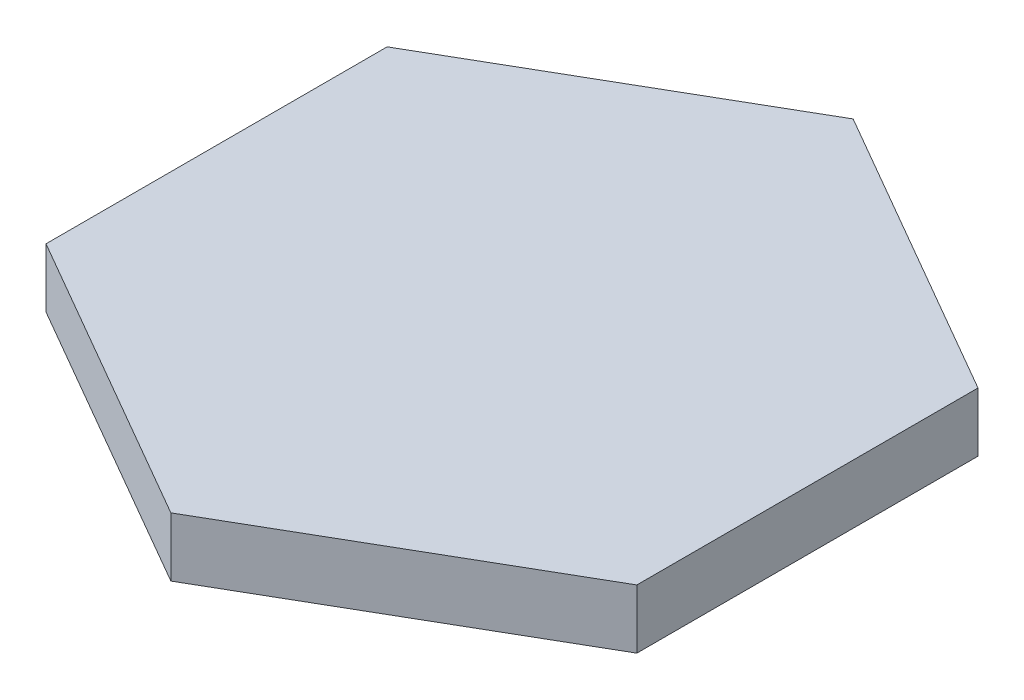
SolidWorks part; units mm, degrees
ref_plane "Front Plane" through (0, 0, 0) normal (0, 0, 1) x (1, 0, 0)
ref_plane "Top Plane" through (0, 0, 0) normal (0, 1, 0) x (1, 0, 0)
ref_plane "Right Plane" through (0, 0, 0) normal (1, 0, 0) x (0, 0, -1)
sketch "Sketch1" plane through (0, 0, 0) normal (0, 1, 0) x (1, 0, 0)
  line L1 (0, 69.282) -> (-60, 34.641)
  line L2 (-60, 34.641) -> (-60, -34.641)
  line L3 (-60, -34.641) -> (0, -69.282)
  line L4 (0, -69.282) -> (60, -34.641)
  line L5 (60, -34.641) -> (60, 34.641)
  line L6 (60, 34.641) -> (0, 69.282)
  circle A0 centre (0, 0) radius 69.282 construction
  dimension "D1" = 60
extrude "Extrude1" add sketch "Sketch1" against normal blind 12
